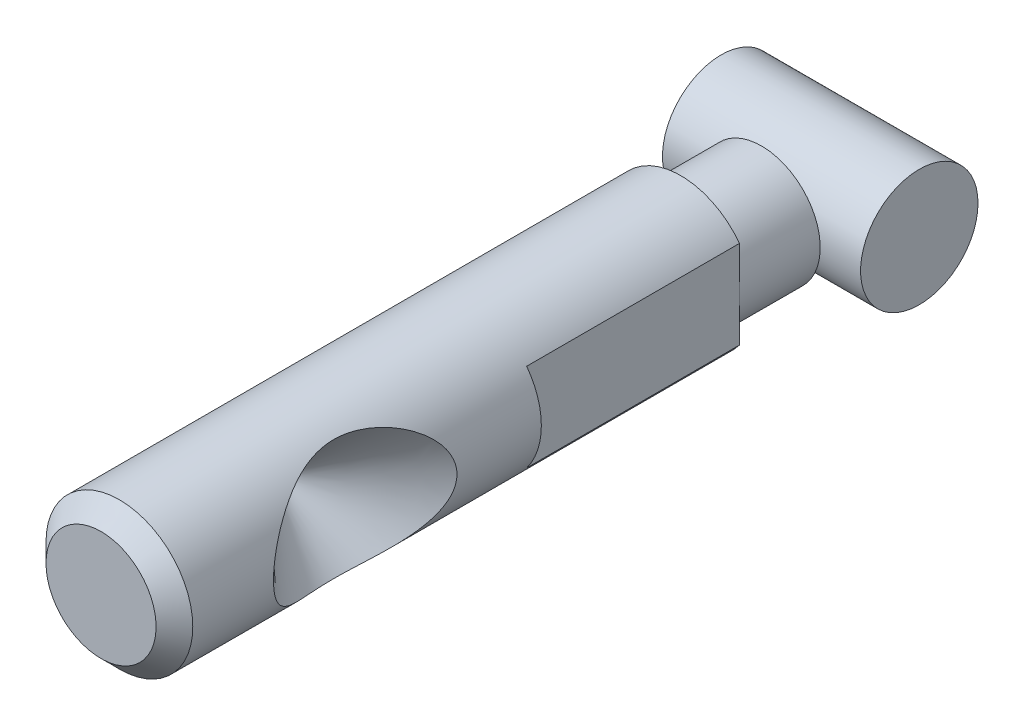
SolidWorks part; units mm, degrees
ref_plane "Front" through (0, 0, 0) normal (0, 0, 1) x (1, 0, 0)
ref_plane "Top" through (0, 0, 0) normal (0, 1, 0) x (1, 0, 0)
ref_plane "Right" through (0, 0, 0) normal (1, 0, 0) x (0, 0, -1)
imported_body "Imported3"
imported_body "Imported4"
sketch "Sketch1" plane through (0, 0, 4) normal (0, 0, -1) x (-1, 0, 0)
  line L2 (4, -3) -> (4, 3)
  line L3 (-4, 3) -> (-4, -3)
  line L4 (4, -3) -> (4, 3)
  line L5 (-4, 3) -> (-4, -3)
  circle A0 centre (0, 0) radius 4
  arc A2 (4, 3) -> (-4, 3) centre (0, 0) ccw
  arc A3 (-4, -3) -> (4, -3) centre (0, 0) ccw
  arc A4 (4, 3) -> (-4, 3) centre (0, 0) ccw
  arc A5 (-4, -3) -> (4, -3) centre (0, 0) ccw
  dimension "D1" = 0
extrude "Cut-Extrude3" cut sketch "Sketch1" against normal blind 5.5 contours A0 L5 M8 M5
mirror "Mirror1" about plane through (0, 0, 0) normal (0, 1, 0) of "Cut-Extrude3"
